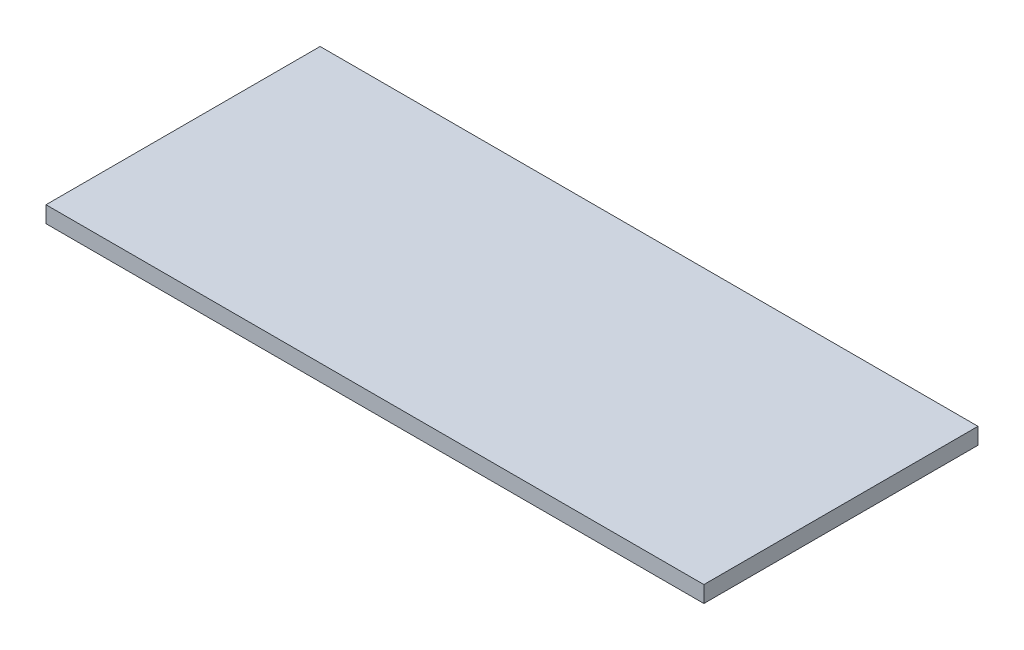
SolidWorks part; units mm, degrees
ref_plane "Front Plane" through (0, 0, 0) normal (0, 0, 1) x (1, 0, 0)
ref_plane "Top Plane" through (0, 0, 0) normal (0, 1, 0) x (1, 0, 0)
ref_plane "Right Plane" through (0, 0, 0) normal (1, 0, 0) x (0, 0, -1)
sketch "Sketch1" plane through (0, 0, 0) normal (0, 1, 0) x (1, 0, 0)
  line L1 (-60, 25) -> (60, 25)
  line L2 (-60, 25) -> (-60, -25)
  line L3 (-60, -25) -> (60, -25)
  line L4 (60, 25) -> (60, -25)
  line L5 (-60, 25) -> (60, -25) construction
  line L6 (-60, -25) -> (60, 25) construction
  point P0 (0, 0)
  dimension "D1" = 50
  dimension "D2" = 120
extrude "Boss-Extrude1" add sketch "Sketch1" along normal blind 3
